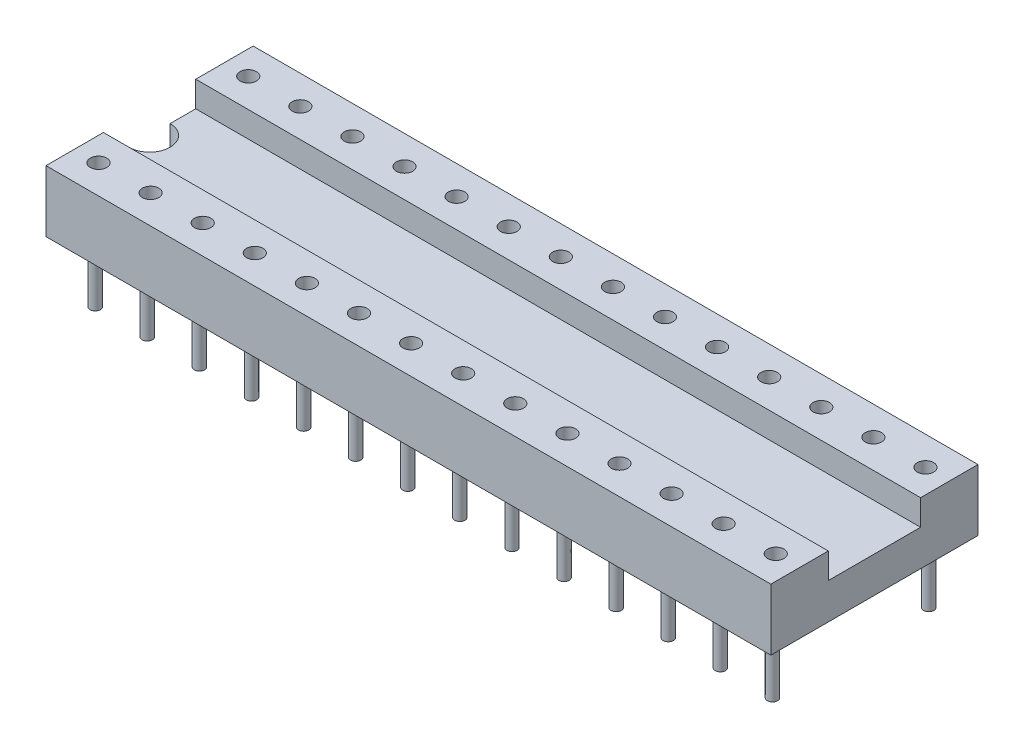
SolidWorks part; units mm, degrees
ref_plane "Plan de face" through (0, 0, 0) normal (0, 0, 1) x (1, 0, 0)
ref_plane "Plan de dessus" through (0, 0, 0) normal (0, 1, 0) x (1, 0, 0)
ref_plane "Plan de droite" through (0, 0, 0) normal (1, 0, 0) x (0, 0, -1)
sketch "Esquisse1" plane through (0, 0, 0) normal (1, 0, 0) x (0, 0, -1)
  line L0 (12.2051, 0) -> (-23.3437, 0) construction
  line L1 (0, -4.6214) -> (0, 25.9507) construction
  line L2 (-5.7968, 1.75) -> (2.763, 1.75) construction
  line L3 (5.7565, 3) -> (-6.8307, 3) construction
  line L4 (5.05, 3.8077) -> (5.05, -1.0493) construction
  line L5 (-5.05, 3.7235) -> (-5.05, -1.0493) construction
  line L6 (-2.25, 3.5071) -> (-2.25, 0.8142) construction
  line L7 (2.25, 3.5071) -> (2.25, 0.8142) construction
  line L8 (-2.25, 1.75) -> (-2.25, 3)
  line L9 (-2.25, 3) -> (-5.05, 3)
  line L10 (-5.05, 3) -> (-5.05, 0)
  line L11 (-5.05, 0) -> (5.05, 0)
  line L12 (5.05, 0) -> (5.05, 3)
  line L13 (5.05, 3) -> (2.25, 3)
  line L14 (2.25, 3) -> (2.25, 1.75)
  line L15 (2.25, 1.75) -> (-2.25, 1.75)
  dimension "D1" = 1.75
  dimension "D2" = 3
  dimension "D3" = 5.05
  dimension "D4" = 5.05
  dimension "D5" = 2.8
  dimension "D6" = 2.8
extrude "Extrusion1" add sketch "Esquisse1" along normal blind 35.34
sketch "Esquisse2" plane through (0, 1.75, 0) normal (0, 1, 0) x (-1, 0, 0)
  line L0 (0, -1) -> (0, 1)
  arc A0 (0, 1) -> (0, -1) centre (0, 0) ccw
extrude "Enlèv. mat.-Extru.1" cut sketch "Esquisse2" against normal through all
sketch "Esquisse3" plane through (0, 3, 0) normal (0, 1, 0) x (-1, 0, 0)
  line L0 (-13.1576, 5.05) -> (2.3638, 5.05) construction
  line L1 (0, 6.1465) -> (0, -6.3771) construction
  line L2 (1.5124, 0) -> (-12.9979, 0) construction
  line L3 (1.0512, 3.65) -> (-15.6055, 3.65) construction
  line L4 (-1.16, 6.2884) -> (-1.16, 1.7827) construction
  circle A0 centre (-1.16, 3.65) radius 0.4
  circle A1 centre (-1.16, -3.65) radius 0.4
  circle A2 centre (-3.7, 3.65) radius 0.4
  circle A3 centre (-3.7, -3.65) radius 0.4
  circle A4 centre (-6.24, 3.65) radius 0.4
  circle A5 centre (-6.24, -3.65) radius 0.4
  circle A6 centre (-8.78, 3.65) radius 0.4
  circle A7 centre (-8.78, -3.65) radius 0.4
  circle A8 centre (-11.32, 3.65) radius 0.4
  circle A9 centre (-11.32, -3.65) radius 0.4
  circle A10 centre (-13.86, 3.65) radius 0.4
  circle A11 centre (-13.86, -3.65) radius 0.4
  circle A12 centre (-16.4, 3.65) radius 0.4
  circle A13 centre (-16.4, -3.65) radius 0.4
  circle A14 centre (-18.94, 3.65) radius 0.4
  circle A15 centre (-18.94, -3.65) radius 0.4
  circle A16 centre (-21.48, 3.65) radius 0.4
  circle A17 centre (-21.48, -3.65) radius 0.4
  circle A18 centre (-24.02, 3.65) radius 0.4
  circle A19 centre (-24.02, -3.65) radius 0.4
  circle A20 centre (-26.56, 3.65) radius 0.4
  circle A21 centre (-26.56, -3.65) radius 0.4
  circle A22 centre (-29.1, 3.65) radius 0.4
  circle A23 centre (-29.1, -3.65) radius 0.4
  circle A24 centre (-31.64, 3.65) radius 0.4
  circle A25 centre (-31.64, -3.65) radius 0.4
  circle A26 centre (-34.18, 3.65) radius 0.4
  circle A27 centre (-34.18, -3.65) radius 0.4
  dimension "D1" = 1.4
  dimension "D2" = 1.16
extrude "Enlèv. mat.-Extru.2" cut sketch "Esquisse3" against normal blind 2.5
sketch "Esquisse5" plane through (0, 0, 0) normal (0, -1, 0) x (1, 0, 0)
  line L0 (-0.4263, 0) -> (10.6481, 0) construction
  line L1 (35.8721, 3.81) -> (-0.4263, 3.81) construction
  circle A0 centre (1.16, 3.81) radius 0.25
  circle A1 centre (1.16, -3.81) radius 0.25
  circle A2 centre (3.7, -3.81) radius 0.25
  circle A3 centre (3.7, 3.81) radius 0.25
  circle A4 centre (6.24, -3.81) radius 0.25
  circle A5 centre (6.24, 3.81) radius 0.25
  circle A6 centre (8.78, -3.81) radius 0.25
  circle A7 centre (8.78, 3.81) radius 0.25
  circle A8 centre (11.32, -3.81) radius 0.25
  circle A9 centre (11.32, 3.81) radius 0.25
  circle A10 centre (13.86, -3.81) radius 0.25
  circle A11 centre (13.86, 3.81) radius 0.25
  circle A12 centre (16.4, -3.81) radius 0.25
  circle A13 centre (16.4, 3.81) radius 0.25
  circle A14 centre (18.94, -3.81) radius 0.25
  circle A15 centre (18.94, 3.81) radius 0.25
  circle A16 centre (21.48, -3.81) radius 0.25
  circle A17 centre (21.48, 3.81) radius 0.25
  circle A18 centre (24.02, -3.81) radius 0.25
  circle A19 centre (24.02, 3.81) radius 0.25
  circle A20 centre (26.56, -3.81) radius 0.25
  circle A21 centre (26.56, 3.81) radius 0.25
  circle A22 centre (29.1, -3.81) radius 0.25
  circle A23 centre (29.1, 3.81) radius 0.25
  circle A24 centre (31.64, -3.81) radius 0.25
  circle A25 centre (31.64, 3.81) radius 0.25
  circle A26 centre (34.18, -3.81) radius 0.25
  circle A27 centre (34.18, 3.81) radius 0.25
  dimension "D1" = 3.81
extrude "Extrusion2" add sketch "Esquisse5" along normal blind 3
